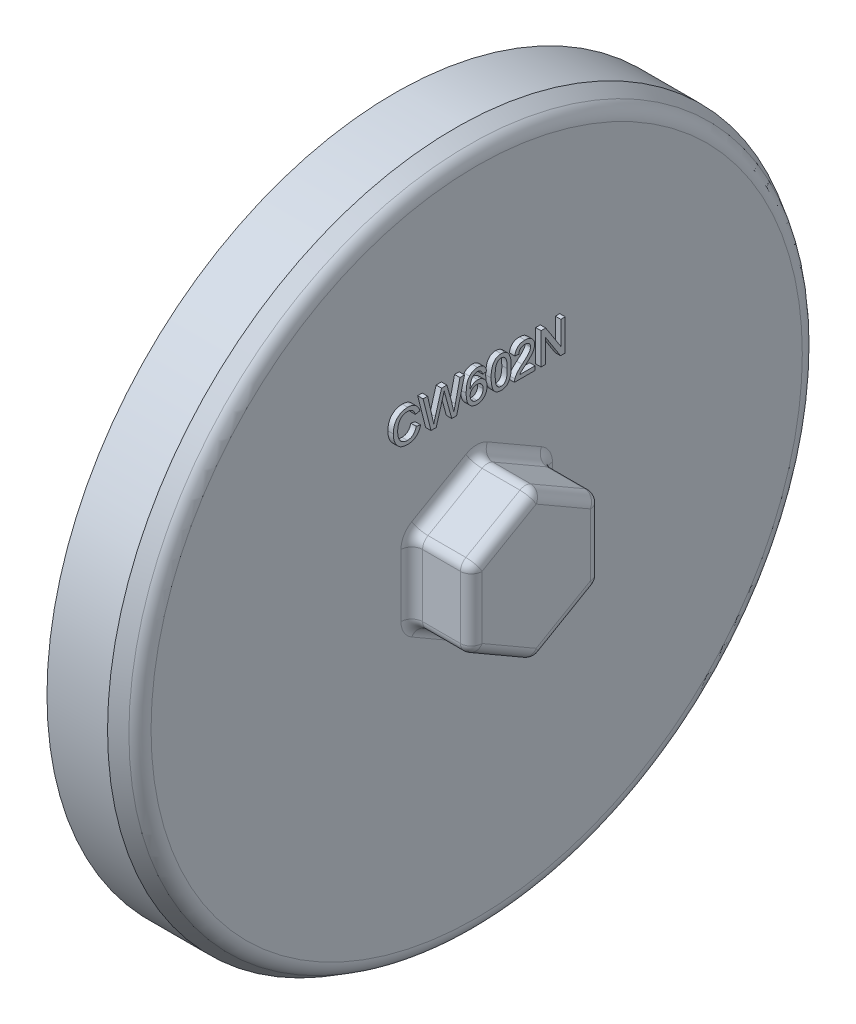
SolidWorks part; units mm, degrees
ref_plane "Face" through (0, 0, 0) normal (0, 0, 1) x (1, 0, 0)
ref_plane "Dessus" through (0, 0, 0) normal (0, 1, 0) x (1, 0, 0)
ref_plane "Côté" through (0, 0, 0) normal (1, 0, 0) x (0, 0, -1)
sketch "Esquisse1" plane through (0, 0, 0) normal (0, 0, 1) x (1, 0, 0)
  line L0 (0, 0) -> (14.7, 0) construction
  line L1 (-0.5, 64.25) -> (10.7, 64.25)
  line L2 (14.7, 60.2085) -> (14.7, 0)
  line L3 (-0.5, 64.25) -> (-0.5, 62.6)
  line L4 (-0.5, 62.6) -> (7.1, 62.6)
  line L5 (7.1, 62.6) -> (7.1, 47.3292)
  line L6 (7.1, 47.3292) -> (5.8, 47.1)
  line L7 (5.8, 47.1) -> (5.8, 46.35)
  line L8 (5.8, 46.35) -> (7.1, 46.1208)
  line L9 (7.1, 46.1208) -> (7.1, 31.75)
  line L10 (7.1, 31.75) -> (0.5, 31.75)
  line L11 (0, 31.25) -> (0, 0)
  line L12 (5.8, 46.725) -> (34.7832, 46.725) construction
  line L13 (10.7, 64.25) -> (13.2, 62.8066)
  line L14 (0, 31.25) -> (0.5, 31.75)
  line L15 (0, 0) -> (14.7, 0)
  arc A0 (14.7, 60.2085) -> (13.2, 62.8066) centre (11.7, 60.2085) ccw
  dimension "D13" = 3
  dimension "D1" = 63.5
  dimension "D2" = 0.75
  dimension "D3" = 20
  dimension "D4" = 1.3
  dimension "D5" = 92.7
  dimension "D6" = 0.5
  dimension "D7" = 7.6
  dimension "D8" = 125.2
  dimension "D9" = 128.5
  dimension "D10" = 15.2
  dimension "D11" = 30
  dimension "D12" = 11.2
  dimension "D14" = 45
  dimension "D15" = 0.5
revolve "Base-Révolution" add sketch "Esquisse1" angle 360 about L0
sketch "Esquisse3" plane through (0, 0, 0) normal (-1, 0, 0) x (0, 0, 1)
  line L1 (12, -5.7735) -> (12, 5.7735)
  line L2 (11, 7.5056) -> (1, 13.2791)
  line L3 (-1, 13.2791) -> (-11, 7.5056)
  line L4 (-12, 5.7735) -> (-12, -5.7735)
  line L5 (-11, -7.5056) -> (-1, -13.2791)
  line L6 (1, -13.2791) -> (11, -7.5056)
  circle A0 centre (0, 0) radius 12 construction
  arc A1 (-1, 13.2791) -> (1, 13.2791) centre (0, 11.547) cw
  arc A2 (-12, 5.7735) -> (-11, 7.5056) centre (-10, 5.7735) cw
  arc A3 (-11, -7.5056) -> (-12, -5.7735) centre (-10, -5.7735) cw
  arc A4 (1, -13.2791) -> (-1, -13.2791) centre (0, -11.547) cw
  arc A5 (11, -7.5056) -> (12, -5.7735) centre (10, -5.7735) ccw
  arc A6 (11, 7.5056) -> (12, 5.7735) centre (10, 5.7735) cw
  dimension "D1" = 24
  dimension "D2" = 2
extrude "Boss.-Extru.1" add sketch "Esquisse3" against normal blind 25.7
fillet "Congé1" radius 2
fillet "Congé2" radius 2
sketch "Esquisse4" plane through (0, 0, 0) normal (0, 0, 1) x (1, 0, 0)
  line L0 (0, 0) -> (21, 0) construction
  line L1 (0, 31.25) -> (0, -31.25) construction
  line L2 (0, 5.75) -> (0, 0)
  line L3 (0, 5.75) -> (21, 5.75)
  line L4 (21, 5.75) -> (21, 0)
  line L5 (0, 0) -> (21, 0)
  dimension "D1" = 21
  dimension "D2" = 11.5
revolve "Enlèvement de matière-Révolution1" cut sketch "Esquisse4"
chamfer "Chanfrein1" distance 1.5 angle 45
sketch "Esquisse5" plane through (14.7, 0, 0) normal (1, 0, 0) x (0, 0, -1)
  text T0 "CW602N" font "Arial" height 6
extrude "Boss.-Extru.2" add sketch "Esquisse5" along normal blind 1
